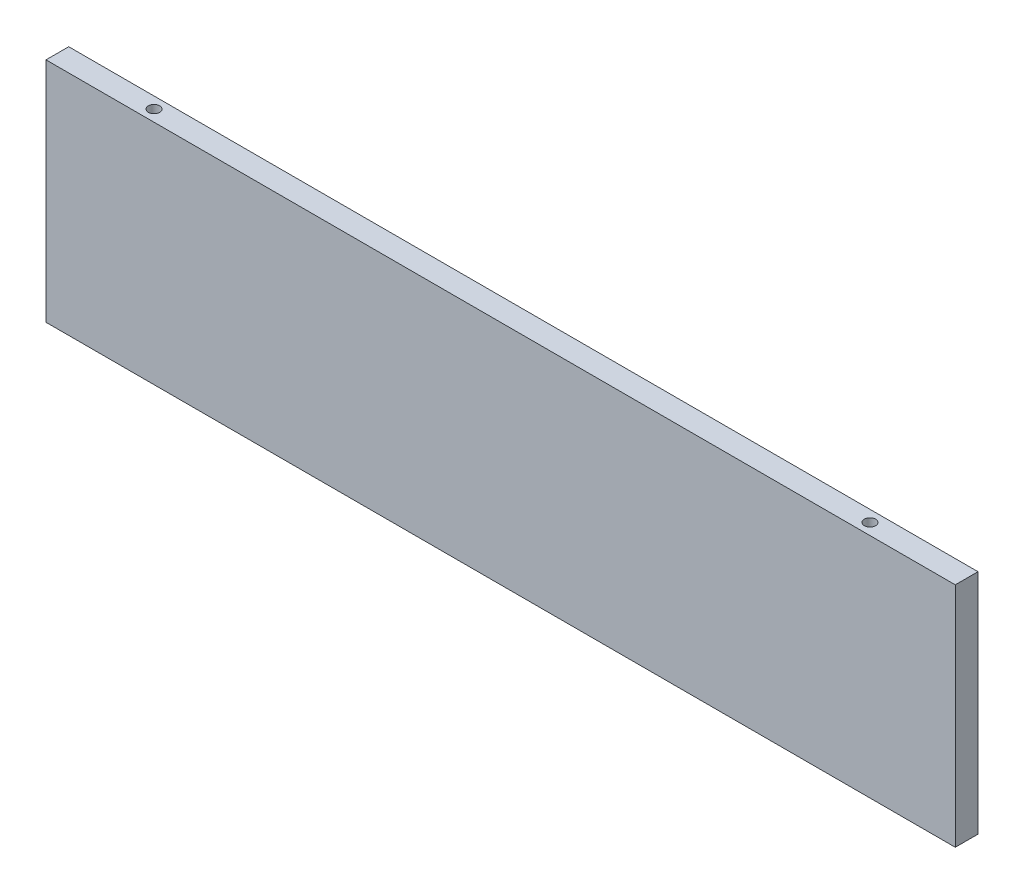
SolidWorks part; units mm, degrees
ref_plane "Front Plane" through (0, 0, 0) normal (0, 0, 1) x (1, 0, 0)
ref_plane "Top Plane" through (0, 0, 0) normal (0, 1, 0) x (1, 0, 0)
ref_plane "Right Plane" through (0, 0, 0) normal (1, 0, 0) x (0, 0, -1)
sketch "Sketch1" plane through (0, 0, 0) normal (0, 0, 1) x (1, 0, 0)
  line L0 (-284.8179, 0) -> (294.0055, 0) construction
  line L1 (0, 142.8266) -> (0, -119.4397) construction
  line L3 (-254, -63.5) -> (254, -63.5)
  line L4 (-254, -63.5) -> (-254, 63.5)
  line L5 (-254, 63.5) -> (254, 63.5)
  line L6 (254, -63.5) -> (254, 63.5)
extrude "Extrude1" add sketch "Sketch1" along normal blind 12.7
sketch "Sketch2" plane through (0, -63.5, 0) normal (0, -1, 0) x (1, 0, 0)
  line L0 (0, 206.0779) -> (0, -185.7131) construction
  line L1 (328.9859, 6.35) -> (-261.8102, 6.35) construction
  line L2 (-254, 12.7) -> (254, 12.7) construction
  circle A0 centre (200, 6.35) radius 3.175
  dimension "D2" = 6.35
  dimension "D3" = 400
  dimension "D1" = 6.35
extrude "Cut-Extrude2" cut sketch "Sketch2" against normal through all
mirror "Mirror1" about plane through (0, 0, 0) normal (1, 0, 0) of "Cut-Extrude2"
sketch "Sketch3" plane through (0, 0, 12.7) normal (0, 0, 1) x (1, 0, 0)
  line L0 (0, -63.5) -> (0, 0)
  line L1 (0, 0) -> (254, 0)
  line L2 (254, -63.5) -> (254, 63.5) construction
  line L3 (-254, -63.5) -> (254, -63.5) construction
extrude "double symmetry" [suppressed] cut sketch "Sketch3" against normal through all and the other way through all
equation "\"D4@Sketch1\" = \"D3@Sketch1\"*.5"
